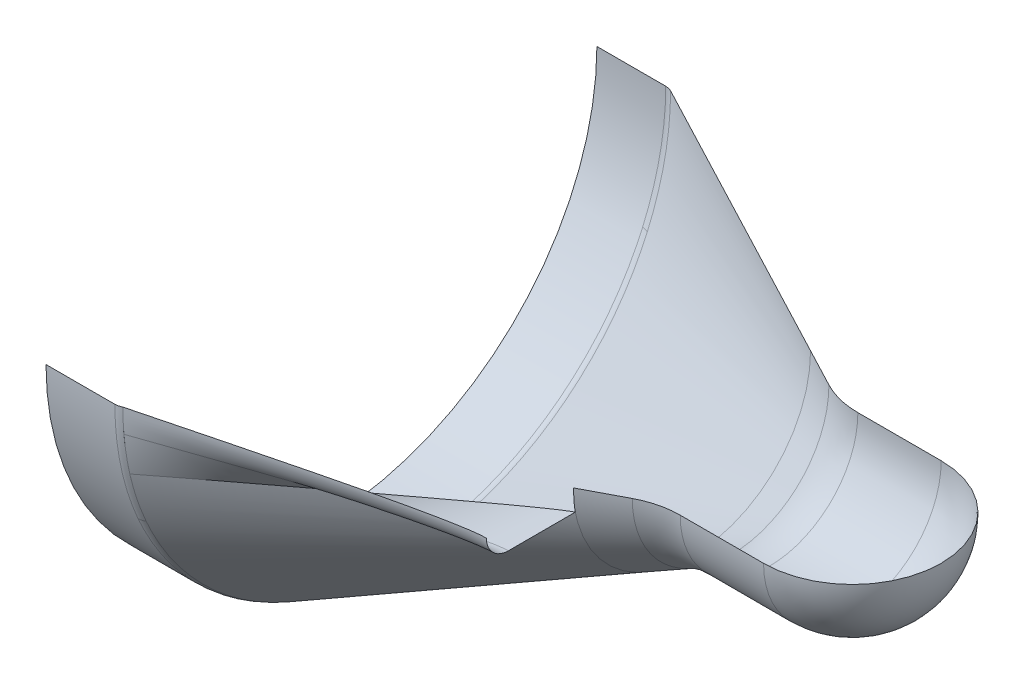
SolidWorks part; units mm, degrees
ref_plane "Vorne" through (0, 0, 0) normal (0, 0, 1) x (1, 0, 0)
ref_plane "Oben" through (0, 0, 0) normal (0, 1, 0) x (1, 0, 0)
ref_plane "Rechts" through (0, 0, 0) normal (1, 0, 0) x (0, 0, -1)
sketch "Skizze1" plane through (0, 0, 0) normal (0, 1, 0) x (1, 0, 0)
  line L0 (0, 0) -> (770.7263, 0) construction
  line L1 (0, 200) -> (50, 200)
  line L2 (54.6536, 198.8512) -> (297.0781, 71.3929)
  line L3 (2, 198) -> (50, 198) construction
  line L4 (0, 198) -> (50, 198) construction
  line L5 (385.5, 64.5) -> (325, 64.5)
  line L6 (53.7229, 197.081) -> (296.1474, 69.6226) construction
  line L7 (385.5, 62.5) -> (325, 62.5) construction
  line L8 (0, 200) -> (0, 198) construction
  line L9 (448, 0) -> (450, 0) construction
  line L10 (385.5, 64.5) -> (385.5, 62.5) construction
  line L12 (0, 200) -> (0, 196.253) construction
  line L19 (2, 198) -> (2, 196.253) construction
  arc A0 (50, 200) -> (54.6536, 198.8512) centre (50, 190) cw
  arc A1 (50, 198) -> (53.7229, 197.081) centre (50, 190) cw construction
  arc A2 (325, 62.5) -> (296.1474, 69.6226) centre (325, 124.5) cw construction
  arc A3 (385.5, 62.5) -> (448, 0) centre (385.5, 0) cw construction
  arc A4 (325, 64.5) -> (297.0781, 71.3929) centre (325, 124.5) cw
  arc A8 (385.5, 64.5) -> (450, 0) centre (385.5, 0) cw
  point P14 (87.3818, 188.4588)
  point P15 (510.3654, -55.7509)
  dimension "D2" = 10
  dimension "D4" = 2
  dimension "D5" = 60
  dimension "D7" = 64.5
  dimension "D3" = 400
  dimension "D6" = 50
  dimension "D8" = 325
  dimension "D13" = 450
surface "Oberfläche-Rotation1" sketch "Skizze1" parameters "D1"=180
ref_plane "Ebene1" through (100, 0, 0) normal (1, 0, 0) x (0, 0, -1)
sketch "Skizze9" plane through (0, 0, 0) normal (0, 0, 1) x (1, 0, 0)
  line L0 (50, -80.3054) -> (54.6536, -80.3054)
  line L1 (50, -200) -> (50, 0) construction
  line L2 (54.6536, -198.8512) -> (54.6536, 0) construction
ref_plane "Ebene2" through (269, 0, 0) normal (1, 0, 0) x (0, 0, -1)
sketch "Skizze11" plane through (269, 0, 0) normal (1, 0, 0) x (0, 0, -1)
  line L0 (-49.3016, -16) -> (-133.3016, -16) construction
  line L2 (-49.3016, -16) -> (-133.3016, -16)
  arc A0 (-149.3016, 0) -> (-133.3016, -16) centre (-133.3016, 0) ccw construction
  arc A2 (-149.3016, 0) -> (-133.3016, -16) centre (-133.3016, 0) ccw
sketch3d "3D-Skizze2"
  arc A0 (54.6536, -80.3054, 181.9144) -> (54.6536, 0, 198.8512) centre (54.6536, 0, 0) ccw construction
  arc A1 (54.6536, -80.3054, 181.9144) -> (54.6536, 0, 198.8512) centre (54.6536, 0, 0) ccw
  point P3 (-144.1975, 0, 0)
  point P4 (-144.1975, 0, 0)
surface "Oberfläche-Ausformung2"
sketch "Skizze13" plane through (0, 0, 0) normal (0, 0, 1) x (1, 0, 0)
  line L0 (269, 0) -> (269, -141.9302)
other "Fläche löschen3"
sketch3d "3D-Skizze3"
  spline S0 degree 3 poles (936.1016, 141.5421, -239.0836) (21.5254, -56.9343, 208.8172) (53.5553, -45.1024, 194.262) (54.709, -44.6042, 193.7542) (54.723, -44.599, 193.7478) (54.7293, -44.5952, 193.7453) (54.7346, -44.5955, 193.7424) (54.7397, -44.596, 193.7395) (54.7542, -44.5967, 193.7316) (54.8091, -44.5954, 193.7022) (54.9455, -44.5785, 193.6325) (55.2385, -44.5375, 193.4839) (55.8247, -44.4505, 193.1876) (56.7736, -44.3094, 192.7082) (58.6714, -44.0261, 191.7495) (62.467, -43.4607, 189.8317) (70.2815, -42.3017, 185.8821) (85.9106, -40.0039, 177.9773) (108.2383, -36.7723, 166.6706) (135.0314, -32.9588, 153.0843) (161.824, -29.1992, 139.4821) (184.1506, -26.1089, 128.1339) (202.0115, -23.6712, 119.0453) (213.1745, -22.1678, 113.3595) (222.1049, -20.9843, 108.8062) (229.1162, -20.0683, 105.2284) (235.8139, -19.2131, 101.8064) (242.5118, -18.3826, 98.3793) (247.8509, -17.7493, 95.6418) (252.3168, -17.2512, 93.3461) (255.751, -16.8895, 91.5768) (259.0304, -16.5728, 89.8819) (261.85, -16.3353, 88.4183) (263.9994, -16.1845, 87.2969) (265.3633, -16.1058, 86.5822) (266.3764, -16.0594, 86.049) (267.0819, -16.033, 85.6766) (267.7524, -16.0142, 85.3214) (276.9309, -15.8558, 80.4409) (252.5489, -17.9256, 93.087) (1151.7825, -0.0482, -384.6755) knots -0.020587 -0.020587 -0.020587 -0.020587 0.000163 0.000293 0.00033 0.000366 0.000384 0.000403 0.00044 0.000588 0.001174 0.002346 0.00469 0.009377 0.015627 0.031252 0.062501 0.124999 0.249995 0.374991 0.499986 0.624982 0.68748 0.749978 0.781227 0.812474 0.848108 0.874965 0.906208 0.922819 0.93745 0.954255 0.968699 0.976897 0.984334 0.987791 0.991085 0.994218 0.99719 1.107397 1.107397 1.107397 1.107397 only from (54.6548, -44.6269, 193.7782) to (269, -16, 84.6566) construction
  spline S1 degree 3 poles (54.6548, -44.6269, 193.7782) (54.6686, -44.6212, 193.7721) (54.6908, -44.612, 193.7622) (54.709, -44.6042, 193.7542) (54.723, -44.599, 193.7478) (54.7293, -44.5952, 193.7453) (54.7346, -44.5955, 193.7424) (54.7397, -44.596, 193.7395) (54.7542, -44.5967, 193.7316) (54.8091, -44.5954, 193.7022) (54.9455, -44.5785, 193.6325) (55.2385, -44.5375, 193.4839) (55.8247, -44.4505, 193.1876) (56.7736, -44.3094, 192.7082) (58.6714, -44.0261, 191.7495) (62.467, -43.4607, 189.8317) (70.2815, -42.3017, 185.8821) (85.9106, -40.0039, 177.9773) (108.2383, -36.7723, 166.6706) (135.0314, -32.9588, 153.0843) (161.824, -29.1992, 139.4821) (184.1506, -26.1089, 128.1339) (202.0115, -23.6712, 119.0453) (213.1745, -22.1678, 113.3595) (222.1049, -20.9843, 108.8062) (229.1162, -20.0683, 105.2284) (235.8139, -19.2131, 101.8064) (242.5118, -18.3826, 98.3793) (247.8509, -17.7493, 95.6418) (252.3168, -17.2512, 93.3461) (255.751, -16.8895, 91.5768) (259.0304, -16.5728, 89.8819) (261.85, -16.3353, 88.4183) (263.9994, -16.1845, 87.2969) (265.3633, -16.1058, 86.5822) (266.3764, -16.0594, 86.049) (267.0819, -16.033, 85.6766) (267.7524, -16.0142, 85.3214) (268.4559, -16.0021, 84.9474) (268.8252, -16, 84.7502) (269, -16, 84.6566) knots 0 0 0 0 0.000163 0.000293 0.00033 0.000366 0.000384 0.000403 0.00044 0.000588 0.001174 0.002346 0.00469 0.009377 0.015627 0.031252 0.062501 0.124999 0.249995 0.374991 0.499986 0.624982 0.68748 0.749978 0.781227 0.812474 0.848108 0.874965 0.906208 0.922819 0.93745 0.954255 0.968699 0.976897 0.984334 0.987791 0.991085 0.994218 0.99719 1 1 1 1
surface "Oberfläche-Trimmen1"
